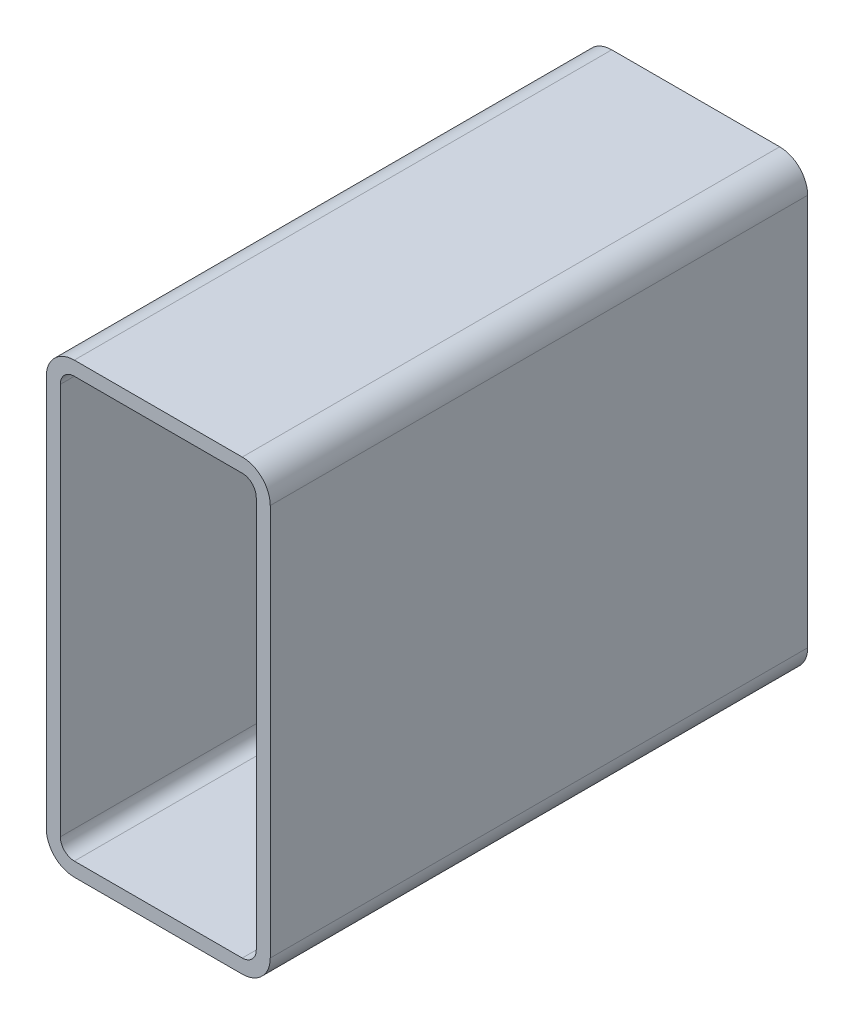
SolidWorks part; units mm, degrees
ref_plane "Front Plane" through (0, 0, 0) normal (0, 0, 1) x (1, 0, 0)
ref_plane "Top Plane" through (0, 0, 0) normal (0, 1, 0) x (1, 0, 0)
ref_plane "Right Plane" through (0, 0, 0) normal (1, 0, 0) x (0, 0, -1)
sketch "Sketch1" plane through (0, 0, 0) normal (0, 0, 1) x (1, 0, 0)
sketch_block_instance "HSS10x5x0.3125-1"
sketch_block "HSS10x5x0.3125"
extrude "Boss-Extrude1" add sketch "Sketch1" along normal blind 304.8
